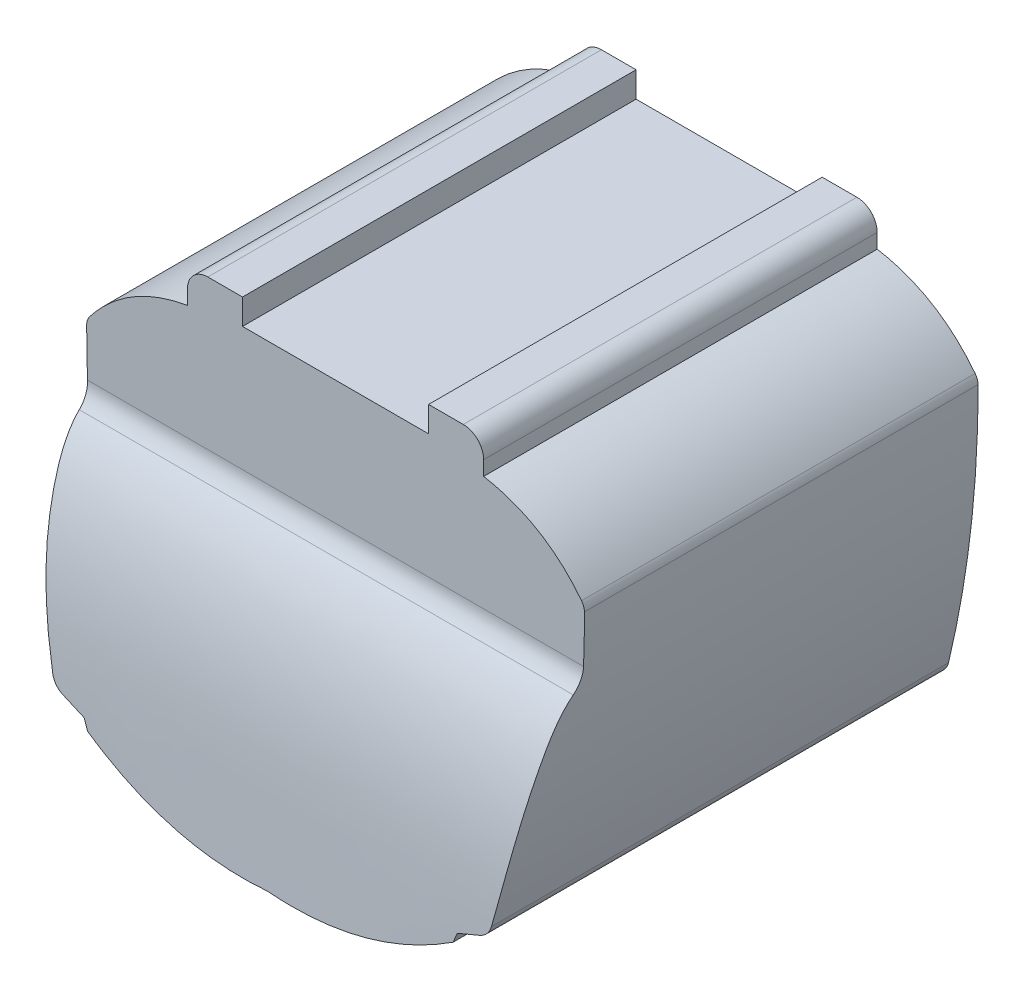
SolidWorks part; units mm, degrees
ref_plane "Plan de face" through (0, 0, 0) normal (0, 0, 1) x (1, 0, 0)
ref_plane "Plan de dessus" through (0, 0, 0) normal (0, 1, 0) x (1, 0, 0)
ref_plane "Plan de droite" through (0, 0, 0) normal (1, 0, 0) x (0, 0, -1)
sketch "Esquisse1" plane through (0, 0, 0) normal (0, 0, 1) x (1, 0, 0)
  line L0 (-55, 29.652) -> (55, 29.652) construction
  line L1 (0, 29.652) -> (0, -66.348) construction
  line L2 (55, -66.348) -> (-55, -66.348) construction
  line L3 (-55, -66.348) -> (-55, 29.652) construction
  line L4 (20.5641, 24.0186) -> (-20.5641, 24.0186)
  line L5 (-20.5641, 24.0186) -> (-20.5641, 29.652)
  line L6 (-20.5641, 29.652) -> (-28.2312, 29.652)
  line L7 (-32.7312, 25.152) -> (-32.7312, 21.952)
  line L8 (-48, -51.348) -> (-41.2377, -54.093)
  line L9 (-41.2377, -54.093) -> (-40.389, -56.1804)
  line L10 (55, -66.348) -> (55, 29.652) construction
  line L11 (41.2377, -54.093) -> (40.389, -56.1804)
  line L12 (48, -51.348) -> (41.2377, -54.093)
  line L13 (32.7312, 25.152) -> (32.7312, 21.952)
  line L14 (20.5641, 29.652) -> (28.2312, 29.652)
  line L15 (20.5641, 24.0186) -> (20.5641, 29.652)
  arc A0 (-28.2312, 29.652) -> (-32.7312, 25.152) centre (-28.2312, 25.152) ccw
  arc A1 (28.2312, 29.652) -> (32.7312, 25.152) centre (28.2312, 25.152) cw
  spline S0 degree 2 poles (-32.7312, 21.952) (-46.608, 19.5612) (-55, 8.152) knots 0 0 0 1 1 1
  spline S1 degree 2 poles (-55, 8.152) (-55.2374, -22.0074) (-48, -51.348) knots 0 0 0 1 1 1
  spline S2 degree 2 poles (0, -66.348) (-21.7835, -68.0724) (-40.389, -56.1804) knots 0 0 0 1 1 1
  spline S3 degree 2 poles (0, -66.348) (21.7835, -68.0724) (40.389, -56.1804) knots 0 0 0 1 1 1
  spline S4 degree 2 poles (55, 8.152) (55.2374, -22.0074) (48, -51.348) knots 0 0 0 1 1 1
  spline S5 degree 2 poles (32.7312, 21.952) (46.608, 19.5612) (55, 8.152) knots 0 0 0 1 1 1
  point P2 (32.7312, 29.652)
  point P12 (-32.7312, 29.652)
  point P13 (-55, 8.152)
  point P14 (-48, -51.348)
  point P37 (0, 24.0186)
  dimension "D3" = 4.5
  dimension "D1" = 96
  dimension "D2" = 55
  dimension "D4" = 7.7
  dimension "D5" = 21.5
  dimension "D6" = 48
  dimension "D7" = 15
extrude "Boss.-Extru.1" add sketch "Esquisse1" along normal blind 102
fillet "Congé1" radius 3 2 edges at (-55, 8.152, 51) (55, 8.152, 51)
fillet "Congé2" radius 4 2 edges at (-48, -51.348, 51) (48, -51.348, 51)
sketch "Esquisse3" plane through (0, 0, 0) normal (1, 0, 0) x (0, 0, -1)
  line L0 (-87, 31.3846) -> (-87, -2.348)
  line L1 (-102, 21.952) -> (-102, 8.9778) construction
  line L2 (-102, 29.652) -> (0, 29.652) construction
  line L3 (-87, -6.4417) -> (-87, -2.348)
  line L4 (-87, 31.3846) -> (-107.2384, 31.3846)
  line L5 (-107.2384, 31.3846) -> (-106.2364, -66.5664)
  line L6 (-106.2364, -66.5664) -> (-102, -66.5664)
  spline S0 degree 3 poles (-102, -66.5664) (-100.8839, -50.0566) (-101.3336, -28.9224) (-91.0923, -8.7858) (-87, -6.4417) knots 0 0 0 0 0.779502 1 1 1 1
  dimension "D1" = 15
  dimension "D2" = 32
extrude "Enlèv. mat.-Extru.1" cut sketch "Esquisse3" against normal through all and the other way through all
fillet "Congé4" radius 6 1 edges at (0, -6.4417, 87)
shell "Coque2" thickness 3
